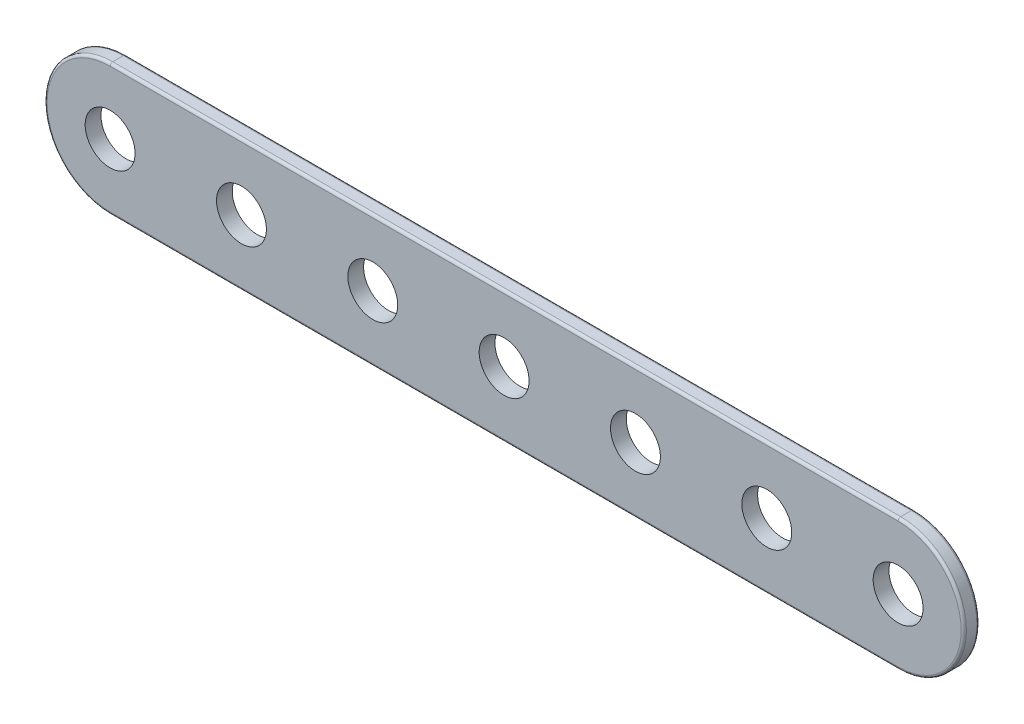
SolidWorks part; units mm, degrees
ref_plane "Front Plane" through (0, 0, 0) normal (0, 0, 1) x (1, 0, 0)
ref_plane "Top Plane" through (0, 0, 0) normal (0, 1, 0) x (1, 0, 0)
ref_plane "Right Plane" through (0, 0, 0) normal (1, 0, 0) x (0, 0, -1)
sketch "Sketch1" plane through (0, 0, 0) normal (0, 0, 1) x (1, 0, 0)
  line L1 (-38.1, -6.35) -> (38.1, -6.35)
  line L3 (-38.1, 6.35) -> (38.1, 6.35)
  line L5 (-38.1, -6.35) -> (38.1, 6.35) construction
  line L6 (-38.1, 6.35) -> (38.1, -6.35) construction
  arc A0 (38.1, 6.35) -> (38.1, -6.35) centre (38.1, 0) cw
  arc A1 (-38.1, 6.35) -> (-38.1, -6.35) centre (-38.1, 0) ccw
  point P0 (0, 0)
  dimension "D2" = 6.35
  dimension "D1" = 76.2
extrude "Boss-Extrude1" add sketch "Sketch1" along normal blind 1.524
sketch "Sketch2" plane through (0, 0, 1.524) normal (0, 0, 1) x (1, 0, 0)
  circle A0 centre (-38.1, 0) radius 2.413
  dimension "D1" = 4.826
extrude "Cut-Extrude1" cut sketch "Sketch2" against normal through all
pattern_linear "LPattern1" count 7 spacing 12.7 along (1, 0, 0) of "Cut-Extrude1"
fillet "Fillet1" radius 0.254 8 edges at (44.45, 0, 0) (0, -6.35, 0) (-44.45, 0, 0) (44.45, 0, 1.524) (0, -6.35, 1.524) (-44.45, 0, 1.524) (0, 6.35, 0) (0, 6.35, 1.524)
